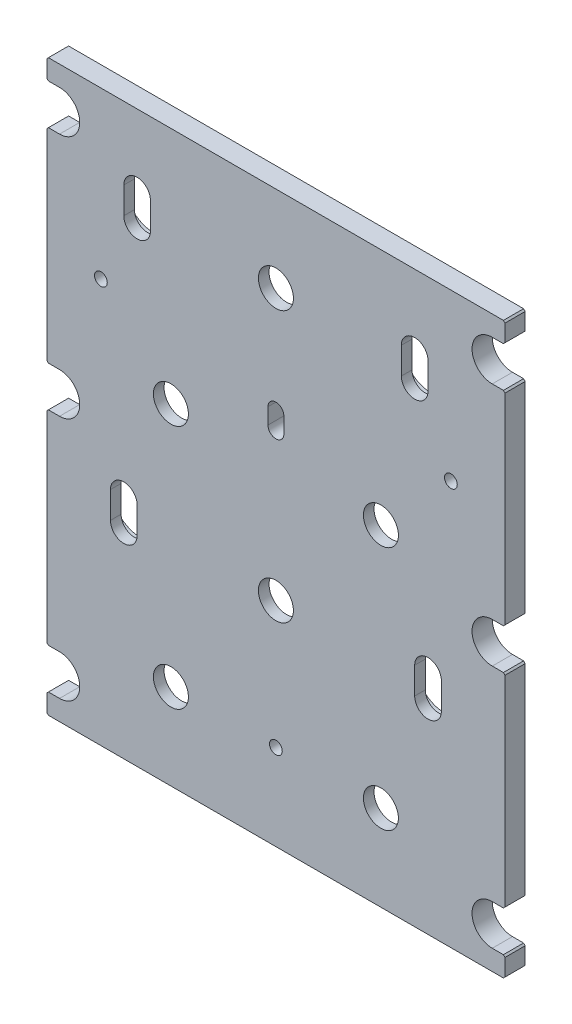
SolidWorks part; units mm, degrees
ref_plane "Front Plane" through (0, 0, 0) normal (0, 0, 1) x (1, 0, 0)
ref_plane "Top Plane" through (0, 0, 0) normal (0, 1, 0) x (1, 0, 0)
ref_plane "Right Plane" through (0, 0, 0) normal (1, 0, 0) x (0, 0, -1)
sketch "Sketch1" plane through (0, 0, 0) normal (0, 0, 1) x (1, 0, 0)
  line L0 (72, 179) -> (72, 0) construction
  line L1 (0, 0) -> (144, 0)
  line L2 (0, 0) -> (0, 6.35)
  line L3 (0, 179) -> (144, 179)
  line L4 (144, 0) -> (144, 6.35)
  line L5 (4, 179) -> (4, 0) construction
  line L6 (140, 179) -> (140, 0) construction
  line L7 (0, 166.3) -> (144, 166.3) construction
  line L8 (0, 12.7) -> (144, 12.7) construction
  line L9 (4, 19.05) -> (0, 19.05)
  line L10 (4, 6.35) -> (0, 6.35)
  line L11 (140, 6.35) -> (144, 6.35)
  line L12 (140, 19.05) -> (144, 19.05)
  line L13 (0, 89.5) -> (144, 89.5) construction
  line L14 (140, 159.95) -> (144, 159.95)
  line L15 (140, 172.65) -> (144, 172.65)
  line L16 (4, 172.65) -> (0, 172.65)
  line L17 (4, 159.95) -> (0, 159.95)
  line L18 (0, 19.05) -> (0, 83.15)
  line L19 (144, 19.05) -> (144, 83.15)
  line L20 (0, 172.65) -> (0, 179)
  line L21 (144, 172.65) -> (144, 179)
  line L22 (4, 95.85) -> (0, 95.85)
  line L23 (4, 83.15) -> (0, 83.15)
  line L24 (140, 83.15) -> (144, 83.15)
  line L25 (140, 95.85) -> (144, 95.85)
  line L26 (0, 95.85) -> (0, 159.95)
  line L27 (144, 95.85) -> (144, 159.95)
  arc A0 (4, 6.35) -> (4, 19.05) centre (4, 12.7) ccw
  arc A1 (140, 6.35) -> (140, 19.05) centre (140, 12.7) cw
  arc A2 (140, 172.65) -> (140, 159.95) centre (140, 166.3) ccw
  arc A3 (4, 172.65) -> (4, 159.95) centre (4, 166.3) cw
  arc A4 (4, 83.15) -> (4, 95.85) centre (4, 89.5) ccw
  arc A5 (140, 83.15) -> (140, 95.85) centre (140, 89.5) cw
  dimension "D6" = 12.7
  dimension "D1" = 144
  dimension "D2" = 179
  dimension "D4" = 68
  dimension "D3" = 68
  dimension "D5" = 12.7
extrude "Panel Base" add sketch "Sketch1" along normal blind 6.35
sketch "Sketch3" plane through (0, 0, 0) normal (0, 0, 1) x (1, 0, 0)
  line L0 (0, 0) -> (144, 0) construction
  line L1 (144, 0) -> (144, 179) construction
  line L2 (144, 179) -> (0, 179) construction
  line L3 (0, 179) -> (0, 0) construction
  line L4 (72, 179) -> (72, 0) construction
  line L5 (0, 89.5) -> (144, 89.5) construction
  line L6 (39, 179) -> (39, 0) construction
  line L7 (105, 179) -> (105, 0) construction
  line L8 (0, 27) -> (144, 27) construction
  line L9 (144, 152) -> (0, 152) construction
  line L10 (0, 67) -> (144, 67) construction
  line L11 (144, 104) -> (0, 104) construction
  line L12 (144, 116) -> (0, 116) construction
  line L13 (24.191, 179) -> (24.191, 0) construction
  line L14 (119.809, 179) -> (119.809, 0) construction
  line L15 (24.191, 156.191) -> (24.191, 147.809)
  line L16 (32.573, 156.191) -> (32.573, 147.809)
  line L17 (115.618, 71.191) -> (115.618, 62.809)
  line L18 (124, 71.191) -> (124, 62.809)
  line L19 (111.427, 156.191) -> (111.427, 147.809)
  line L20 (119.809, 156.191) -> (119.809, 147.809)
  line L21 (20, 71.191) -> (20, 62.809)
  line L23 (28.382, 71.191) -> (28.382, 62.809)
  circle A0 centre (39, 27) radius 5.5
  circle A1 centre (105, 27) radius 5.5
  circle A2 centre (72, 67) radius 5.5
  circle A3 centre (39, 104) radius 5.5
  circle A4 centre (105, 104) radius 5.5
  circle A5 centre (72, 152) radius 5.5
  arc A6 (28.382, 71.191) -> (20, 71.191) centre (24.191, 71.191) ccw
  arc A7 (28.382, 62.809) -> (20, 62.809) centre (24.191, 62.809) cw
  arc A8 (32.573, 156.191) -> (24.191, 156.191) centre (28.382, 156.191) ccw
  arc A9 (32.573, 147.809) -> (24.191, 147.809) centre (28.382, 147.809) cw
  arc A10 (124, 71.191) -> (115.618, 71.191) centre (119.809, 71.191) ccw
  arc A11 (124, 62.809) -> (115.618, 62.809) centre (119.809, 62.809) cw
  arc A12 (119.809, 156.191) -> (111.427, 156.191) centre (115.618, 156.191) ccw
  arc A13 (119.809, 147.809) -> (111.427, 147.809) centre (115.618, 147.809) cw
  dimension "D3" = 11
  dimension "D4" = 11
  dimension "D6" = 11
  dimension "D7" = 11
  dimension "D8" = 11
  dimension "D9" = 11
  dimension "D1" = 27
  dimension "D2" = 27
  dimension "D5" = 40
  dimension "D10" = 36
  dimension "D11" = 12
  dimension "D12" = 24.191
  dimension "D13" = 39
extrude "Dial and Switch Holes" cut sketch "Sketch3" along normal through all
sketch "Sketch4" plane through (0, 0, 0) normal (0, 0, 1) x (1, 0, 0)
  line L0 (72, 179) -> (72, 0) construction
  line L1 (144, 179) -> (0, 179) construction
  line L2 (0, 0) -> (144, 0) construction
  line L3 (144, 121) -> (74.5, 121) construction
  line L4 (144, 111) -> (74.5, 111) construction
  line L5 (144, 116) -> (0, 116)
  line L6 (144, 116) -> (0, 116) construction
  line L7 (69.5, 179) -> (69.5, 121) construction
  line L8 (74.5, 179) -> (74.5, 121) construction
  line L9 (74.5, 118.5) -> (74.5, 113.5)
  line L10 (74.5, 179) -> (74.5, 0) construction
  line L11 (69.5, 121) -> (0, 121) construction
  line L12 (144, 121) -> (0, 121) construction
  line L13 (69.5, 118.5) -> (69.5, 113.5)
  line L14 (69.5, 179) -> (69.5, 0) construction
  line L15 (69.5, 111) -> (69.5, 0) construction
  line L16 (69.5, 111) -> (0, 111) construction
  line L17 (144, 111) -> (0, 111) construction
  line L18 (74.5, 111) -> (74.5, 0) construction
  arc A0 (74.5, 118.5) -> (69.5, 118.5) centre (72, 118.5) ccw
  arc A1 (74.5, 113.5) -> (69.5, 113.5) centre (72, 113.5) cw
  dimension "D2" = 2.5
  dimension "D3" = 2.5
  dimension "D4" = 5
  dimension "D5" = 5
  dimension "D1" = 63
extrude "Nose Illumination Hole" cut sketch "Sketch4" along normal through all
draft "Nose Illumination Draft" [suppressed] type of draft neutral plane draft angle 22.5 faces to draft 4 parameters "D1"=22.5
sketch "Sketch5" plane through (0, 0, 0) normal (0, 0, 1) x (1, 0, 0)
  line L0 (39, 27) -> (105, 27) construction
  line L1 (17, 127) -> (127, 127) construction
  line L2 (72, 179) -> (72, 0) construction
  line L3 (144, 179) -> (0, 179) construction
  line L4 (0, 0) -> (144, 0) construction
  line L5 (17, 179) -> (17, 0) construction
  line L6 (127, 179) -> (127, 0) construction
  line L7 (39, 127) -> (105, 127) construction
  circle A0 centre (72, 27) radius 2
  circle A1 centre (127, 127) radius 2
  circle A2 centre (17, 127) radius 2
  dimension "D1" = 4
  dimension "D2" = 4
  dimension "D3" = 4
extrude "Panel Screw Holes" cut sketch "Sketch5" along normal through all
sketch "Sketch6" plane through (0, 0, 0) normal (0, 0, -1) x (-1, 0, 0)
  line L0 (-28.382, 160.382) -> (-28.382, 143.618) construction
  line L1 (-115.618, 160.382) -> (-115.618, 143.618) construction
  circle A0 centre (-105, 27) radius 9.5
  circle A1 centre (-39, 27) radius 9.5
  circle A2 centre (-72, 67) radius 9.5
  circle A3 centre (-39, 104) radius 9.5
  circle A4 centre (-105, 104) radius 9.5
  circle A5 centre (-72, 152) radius 9.5
  circle A6 centre (-28.382, 152) radius 9.5
  circle A7 centre (-115.618, 152) radius 9.5
  circle A8 centre (-119.809, 67) radius 9.5
  circle A9 centre (-24.191, 67) radius 9.5
  arc A11 (-24.191, 156.191) -> (-32.573, 156.191) centre (-28.382, 156.191) ccw construction
  arc A12 (-32.573, 147.809) -> (-24.191, 147.809) centre (-28.382, 147.809) ccw construction
  arc A13 (-111.427, 156.191) -> (-119.809, 156.191) centre (-115.618, 156.191) ccw construction
  arc A14 (-119.809, 147.809) -> (-111.427, 147.809) centre (-115.618, 147.809) ccw construction
  dimension "D2" = 19
  dimension "D3" = 19
  dimension "D4" = 19
  dimension "D5" = 19
  dimension "D6" = 19
  dimension "D7" = 19
  dimension "D8" = 19
  dimension "D9" = 19
  dimension "D10" = 19
  dimension "D11" = 19
extrude "Back Nut Recess" cut sketch "Sketch6" against normal blind 3
sketch "Sketch7" plane through (0, 0, 0) normal (0, 0, -1) x (-1, 0, 0)
  line L0 (-74.5, 113.5) -> (-74.5, 118.5) construction
  line L1 (-69.5, 113.5) -> (-69.5, 118.5) construction
  line L2 (-75.5, 113.5) -> (-75.5, 118.5)
  line L3 (-68.5, 113.5) -> (-68.5, 118.5)
  arc A0 (-69.5, 118.5) -> (-74.5, 118.5) centre (-72, 118.5) ccw construction
  arc A1 (-74.5, 113.5) -> (-69.5, 113.5) centre (-72, 113.5) ccw construction
  arc A2 (-68.5, 118.5) -> (-75.5, 118.5) centre (-72, 118.5) ccw
  arc A3 (-75.5, 113.5) -> (-68.5, 113.5) centre (-72, 113.5) ccw
  dimension "D1" = 1
extrude "Nose Illuminication Back Recess" cut sketch "Sketch7" against normal blind 1
sketch "Sketch9" plane through (0, 0, 0) normal (0, 0, -1) x (-1, 0, 0)
  line L44 (-140, 156.775) -> (-140.825, 156.775)
  line L45 (-140.825, 156.775) -> (-140.825, 99.025)
  line L46 (-140.825, 99.025) -> (-140, 99.025)
  line L47 (-140, 79.975) -> (-140.825, 79.975)
  line L48 (-140.825, 79.975) -> (-140.825, 22.225)
  line L49 (-140.825, 22.225) -> (-140, 22.225)
  line L50 (-140, 3.175) -> (-4, 3.175)
  line L51 (-4, 22.225) -> (-3.175, 22.225)
  line L52 (-3.175, 22.225) -> (-3.175, 79.975)
  line L53 (-3.175, 79.975) -> (-4, 79.975)
  line L54 (-4, 99.025) -> (-3.175, 99.025)
  line L55 (-3.175, 99.025) -> (-3.175, 156.775)
  line L56 (-3.175, 156.775) -> (-4, 156.775)
  line L57 (-4, 175.825) -> (-140, 175.825)
  line L59 (-140.825, 151.4175) -> (-140.825, 104.3825)
  line L62 (-140.825, 74.6175) -> (-140.825, 27.5825)
  line L64 (-124.4457, 3.175) -> (-19.5543, 3.175)
  line L66 (-3.175, 27.5825) -> (-3.175, 74.6175)
  line L69 (-3.175, 104.3825) -> (-3.175, 151.4175)
  line L71 (-19.5543, 175.825) -> (-124.4457, 175.825)
  arc A6 (-140.825, 151.4175) -> (-136.685, 157.3705) centre (-134.475, 151.4175) cw
  arc A7 (-136.685, 98.4295) -> (-140.825, 104.3825) centre (-134.475, 104.3825) cw
  arc A8 (-140.825, 74.6175) -> (-136.685, 80.5705) centre (-134.475, 74.6175) cw
  arc A9 (-136.685, 21.6295) -> (-140.825, 27.5825) centre (-134.475, 27.5825) cw
  arc A10 (-124.4457, 3.175) -> (-130.6674, 10.795) centre (-124.4457, 9.525) cw
  arc A11 (-13.3326, 10.795) -> (-19.5543, 3.175) centre (-19.5543, 9.525) cw
  arc A12 (-140, 156.775) -> (-140, 175.825) centre (-140, 166.3) ccw
  arc A13 (-140, 79.975) -> (-140, 99.025) centre (-140, 89.5) ccw
  arc A14 (-140, 3.175) -> (-140, 22.225) centre (-140, 12.7) ccw
  arc A15 (-4, 22.225) -> (-4, 3.175) centre (-4, 12.7) ccw
  arc A16 (-4, 99.025) -> (-4, 79.975) centre (-4, 89.5) ccw
  arc A17 (-4, 175.825) -> (-4, 156.775) centre (-4, 166.3) ccw
  arc A18 (-136.685, 157.3705) -> (-130.6674, 168.205) centre (-140, 166.3) ccw
  arc A19 (-136.685, 80.5705) -> (-136.685, 98.4295) centre (-140, 89.5) ccw
  arc A20 (-130.6674, 10.795) -> (-136.685, 21.6295) centre (-140, 12.7) ccw
  arc A21 (-7.315, 21.6295) -> (-13.3326, 10.795) centre (-4, 12.7) ccw
  arc A22 (-7.315, 98.4295) -> (-7.315, 80.5705) centre (-4, 89.5) ccw
  arc A23 (-13.3326, 168.205) -> (-7.315, 157.3705) centre (-4, 166.3) ccw
  arc A24 (-3.175, 27.5825) -> (-7.315, 21.6295) centre (-9.525, 27.5825) cw
  arc A25 (-7.315, 80.5705) -> (-3.175, 74.6175) centre (-9.525, 74.6175) cw
  arc A26 (-3.175, 104.3825) -> (-7.315, 98.4295) centre (-9.525, 104.3825) cw
  arc A27 (-7.315, 157.3705) -> (-3.175, 151.4175) centre (-9.525, 151.4175) cw
  arc A28 (-19.5543, 175.825) -> (-13.3326, 168.205) centre (-19.5543, 169.475) cw
  arc A29 (-130.6674, 168.205) -> (-124.4457, 175.825) centre (-124.4457, 169.475) cw
  dimension "D2" = 6.35
  dimension "D1" = 3.175
extrude "Back Recess" cut sketch "Sketch9" against normal blind 1
sketch "Sketch11" plane through (0, 0, 0) normal (0, 0, -1) x (-1, 0, 0)
  line L0 (-137.65, 166.3) -> (-6.35, 166.3) construction
  line L1 (-137.65, 125) -> (-6.35, 125) construction
  line L2 (-133.65, 89.5) -> (-10.35, 89.5) construction
  line L3 (-137.65, 12.7) -> (-6.35, 12.7) construction
  line L4 (-72, 67) -> (-119.809, 67) construction
  line L5 (-105, 27) -> (-39, 27) construction
  line L6 (-72, 67) -> (-72, 12.7) construction
  line L7 (-137.65, 47) -> (-6.35, 47) construction
  line L8 (-18.882, 166.3) -> (-18.882, 12.7) construction
  line L9 (-125.118, 166.3) -> (-125.118, 12.7) construction
  line L10 (-137.65, 19.05) -> (-137.65, 83.15)
  line L11 (-137.65, 12.7) -> (-137.65, 166.3) construction
  line L12 (-72, 67) -> (-24.191, 67) construction
  line L13 (-6.35, 83.15) -> (-6.35, 19.05)
  line L14 (-6.35, 166.3) -> (-6.35, 12.7) construction
  line L15 (-95.9045, 166.3) -> (-95.9045, 47) construction
  line L16 (-48.0955, 166.3) -> (-48.0955, 47) construction
  line L17 (-134.475, 12.7) -> (-134.475, 166.3) construction
  line L18 (-9.525, 166.3) -> (-9.525, 12.7) construction
  circle A0 centre (-129.475, 47) radius 3.175
  circle A1 centre (-14.525, 47) radius 3.175
  arc A2 (-140, 83.15) -> (-140, 95.85) centre (-140, 89.5) ccw construction
  arc A3 (-4, 95.85) -> (-4, 83.15) centre (-4, 89.5) ccw construction
  circle A4 centre (-117.8842, 125) radius 3.175
  circle A5 centre (-128.118, 158.8) radius 3.175
  circle A6 centre (-15.882, 158.8) radius 3.175
  circle A7 centre (-128.118, 20.2) radius 3.175
  circle A8 centre (-15.882, 20.2) radius 3.175
  circle A9 centre (-85.9045, 47) radius 3.175
  circle A10 centre (-58.0955, 47) radius 3.175
  circle A11 centre (-72, 94.5) radius 3.175
  circle A12 centre (-125.118, 87) radius 3.175
  circle A13 centre (-18.882, 87) radius 3.175
  circle A14 centre (-95.9045, 166.3) radius 3.175
  circle A15 centre (-48.0955, 166.3) radius 3.175
  circle A16 centre (-95.9045, 125) radius 3.175
  circle A17 centre (-48.0955, 125) radius 3.175
  circle A18 centre (-26.1158, 125) radius 3.175
  circle A20 centre (-72, 12.7) radius 3.175
  dimension "D3" = 3.175
  dimension "D1" = 6.35
  dimension "D2" = 6.35
  dimension "D4" = 3.175
extrude "Extrude5" cut sketch "Sketch11" against normal blind 5
chamfer "Chamfer3" distance 0.5 angle 45 16 edges at (144, 179, 3.175) (144, 172.65, 3.175) (144, 159.95, 3.175) (144, 95.85, 3.175) (144, 83.15, 3.175) (144, 19.05, 3.175) (144, 6.35, 3.175) (144, 0, 3.175) (0, 0, 3.175) (0, 6.35, 3.175) (0, 19.05, 3.175) (0, 83.15, 3.175) (0, 95.85, 3.175) (0, 159.95, 3.175) (0, 172.65, 3.175) (0, 179, 3.175)
ref_plane "Plane1" through (0, 0, 26.35) normal (0, 0, 1) x (1, 0, 0)
chamfer "Chamfer2" distance 0.5 angle 45
chamfer "Chamfer4" distance 0.5 angle 45
chamfer "Chamfer5" distance 0.5 angle 45
